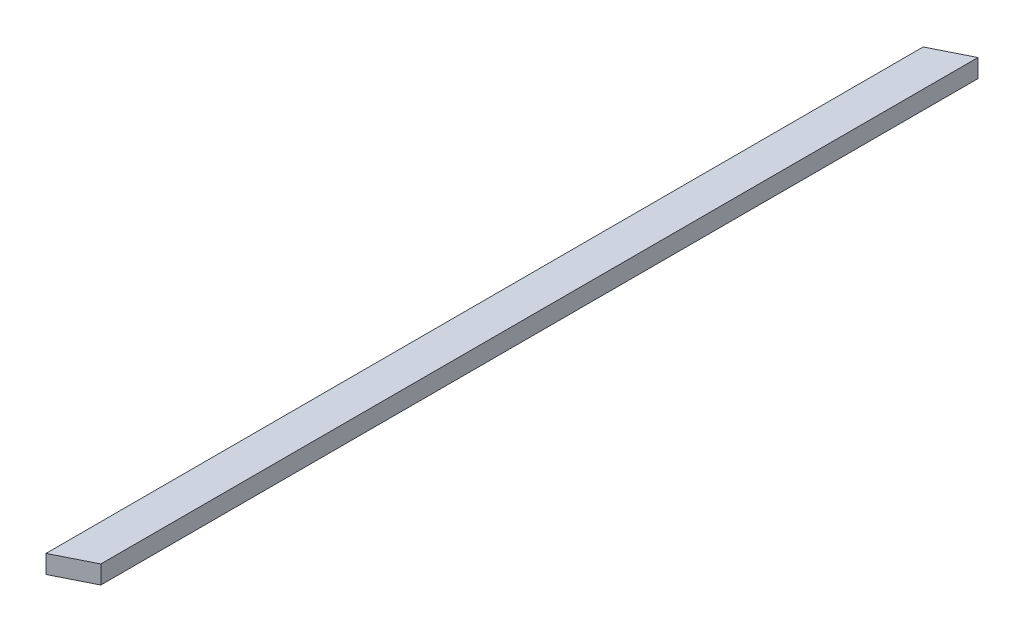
SolidWorks part; units mm, degrees
ref_plane "Front Plane" through (0, 0, 0) normal (0, 0, 1) x (1, 0, 0)
ref_plane "Top Plane" through (0, 0, 0) normal (0, 1, 0) x (1, 0, 0)
ref_plane "Right Plane" through (0, 0, 0) normal (1, 0, 0) x (0, 0, -1)
sketch "Sketch1" plane through (0, 0, 0) normal (0, 1, 0) x (1, 0, 0)
  line L0 (0, 0) -> (0, -2438.4)
  line L1 (0, -2438.4) -> (-101.6, -2489.211)
  line L2 (-101.6, -2489.211) -> (-101.6, -50.811)
  line L3 (-101.6, -50.811) -> (0, 0)
  line L4 (0, 0) -> (-224.0699, 0) construction
  dimension "D1" = 2438.4
  dimension "D2" = 26.57
  dimension "D3" = 101.6
extrude "Boss-Extrude1" add sketch "Sketch1" along normal blind 50.8
